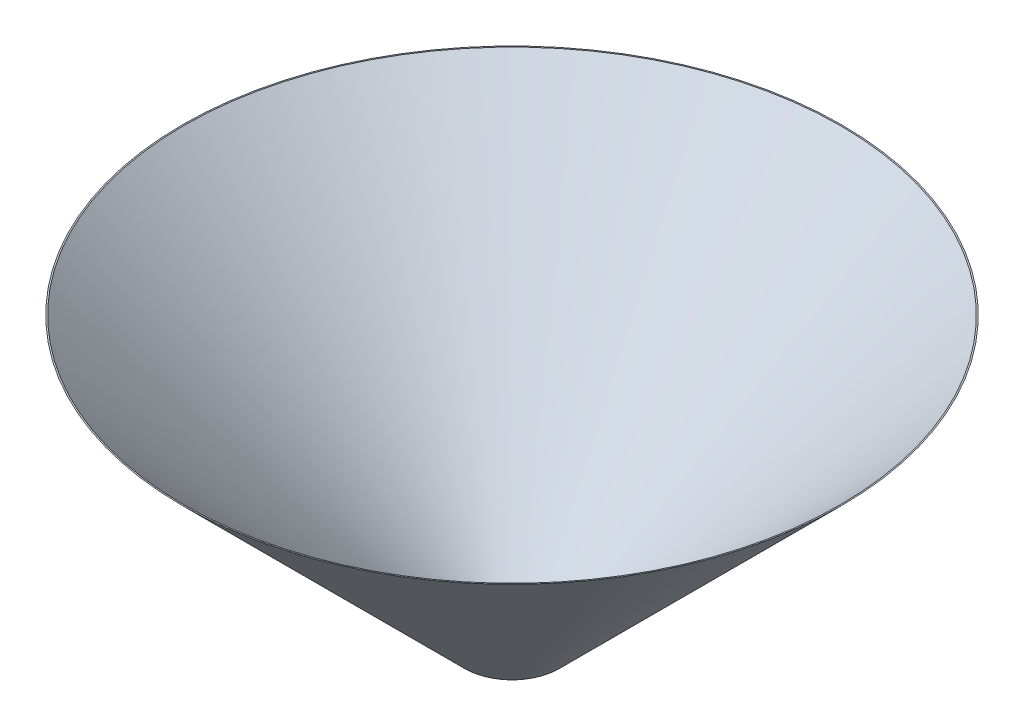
SolidWorks part; units mm, degrees
ref_plane "Front Plane" through (0, 0, 0) normal (0, 0, 1) x (1, 0, 0)
ref_plane "Top Plane" through (0, 0, 0) normal (0, 1, 0) x (1, 0, 0)
ref_plane "Right Plane" through (0, 0, 0) normal (1, 0, 0) x (0, 0, -1)
sketch "Sketch2" plane through (0, 0, 0) normal (0, 1, 0) x (1, 0, 0)
  circle A0 centre (0, 0) radius 50
extrude "Boss-Extrude2" add sketch "Sketch2" along normal blind 300 draft 45
shell "Shell1" thickness 1
